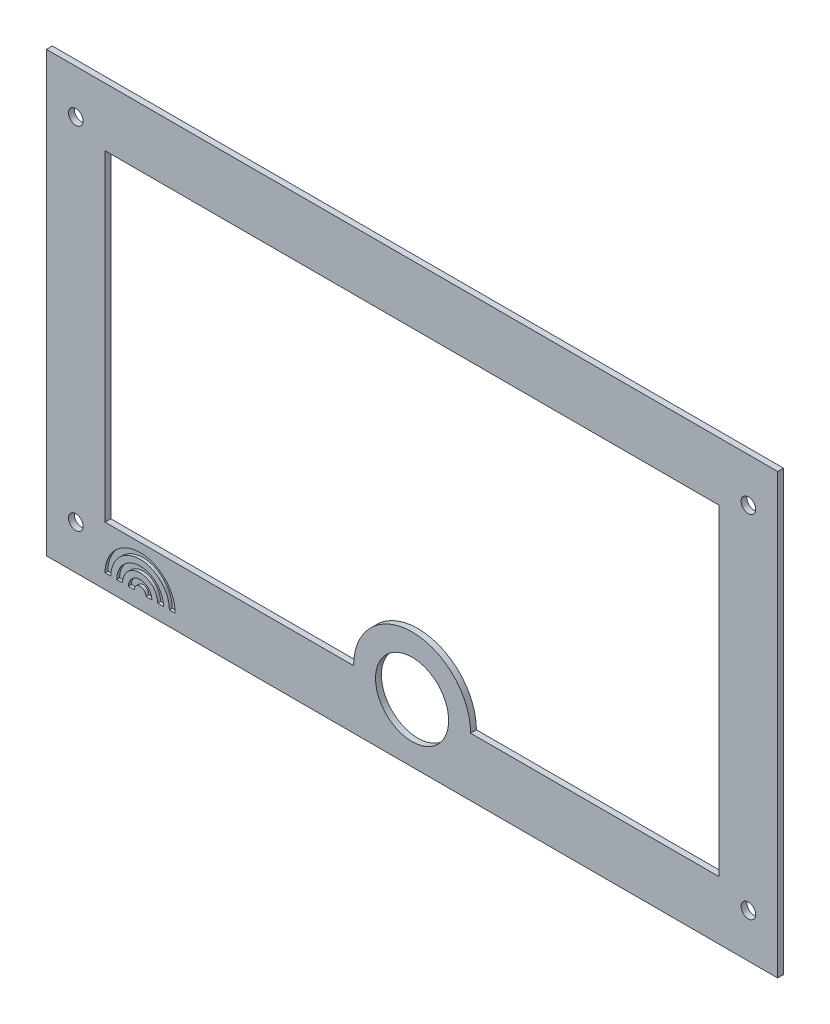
SolidWorks part; units mm, degrees
ref_plane "Front Plane" through (0, 0, 0) normal (0, 0, 1) x (1, 0, 0)
ref_plane "Top Plane" through (0, 0, 0) normal (0, 1, 0) x (1, 0, 0)
ref_plane "Right Plane" through (0, 0, 0) normal (1, 0, 0) x (0, 0, -1)
imported_body "Imported1"
sketch "Sketch1" plane through (0, 0, 2) normal (0, 0, 1) x (1, 0, 0)
  line L0 (-105, -70) -> (-103, -70)
  line L1 (-91, -70) -> (-89, -70)
  line L2 (-87, -70) -> (-85, -70)
  line L3 (-83, -70) -> (-81, -70)
  line L4 (-97, -70) -> (-95, -70)
  line L5 (-101, -70) -> (-99, -70)
  line L6 (125, -75) -> (-125, -75) construction
  line L7 (-125, -75) -> (-125, 75) construction
  arc A0 (-91, -70) -> (-95, -70) centre (-93, -70) ccw
  arc A1 (-89, -70) -> (-97, -70) centre (-93, -70) ccw
  arc A2 (-87, -70) -> (-99, -70) centre (-93, -70) ccw
  arc A3 (-85, -70) -> (-101, -70) centre (-93, -70) ccw
  arc A4 (-83, -70) -> (-103, -70) centre (-93, -70) ccw
  arc A5 (-81, -70) -> (-105, -70) centre (-93, -70) ccw
  dimension "D1" = 5
  dimension "D2" = 20
extrude "Cut-Extrude1" cut sketch "Sketch1" against normal blind 1
